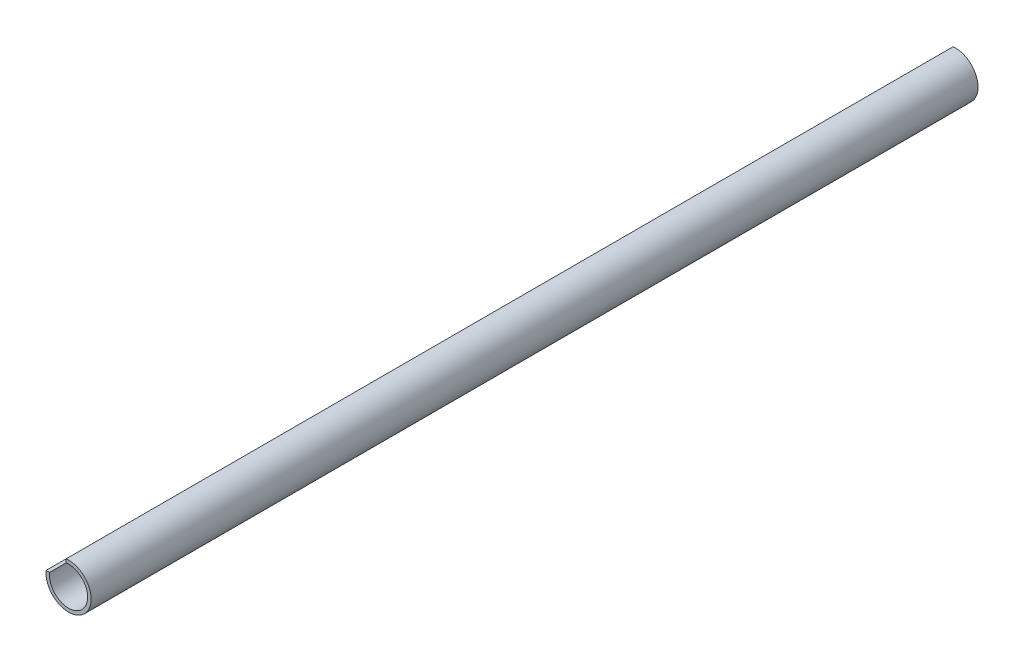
SolidWorks part; units mm, degrees
ref_plane "Plan1" through (0, 0, 0) normal (0, 0, 1) x (1, 0, 0)
ref_plane "Plan2" through (0, 0, 0) normal (0, 1, 0) x (1, 0, 0)
ref_plane "Plan3" through (0, 0, 0) normal (1, 0, 0) x (0, 0, -1)
sketch "Esquisse1" plane through (0, 0, 0) normal (0, 0, 1) x (1, 0, 0)
  circle A0 centre (0, 0) radius 11
  circle A1 centre (0, 0) radius 13
  dimension "Diamètre ext. de 45" = 22
  dimension "Diamètre int. de 45" = 26
extrude "Base-Extrusion" add sketch "Esquisse1" along normal blind 511.175
sketch "Esquisse2" plane through (0, 0, 511.175) normal (0, 0, 1) x (1, 0, 0)
  line L0 (0, 0) -> (-16.7476, 0) construction
  line L1 (0, 0) -> (-1.4142, 1.4142) construction
  line L2 (-1.4142, 1.4142) -> (-1.4142, 24.5858)
  line L3 (-1.4142, 1.4142) -> (-24.5858, 1.4142)
  line L4 (-24.5858, 1.4142) -> (-1.4142, 24.5858)
  dimension "D1" = 45
  dimension "D2" = 45
  dimension "D3" = 2
extrude "Enlèv. mat.-Extru.1" cut sketch "Esquisse2" against normal through all
